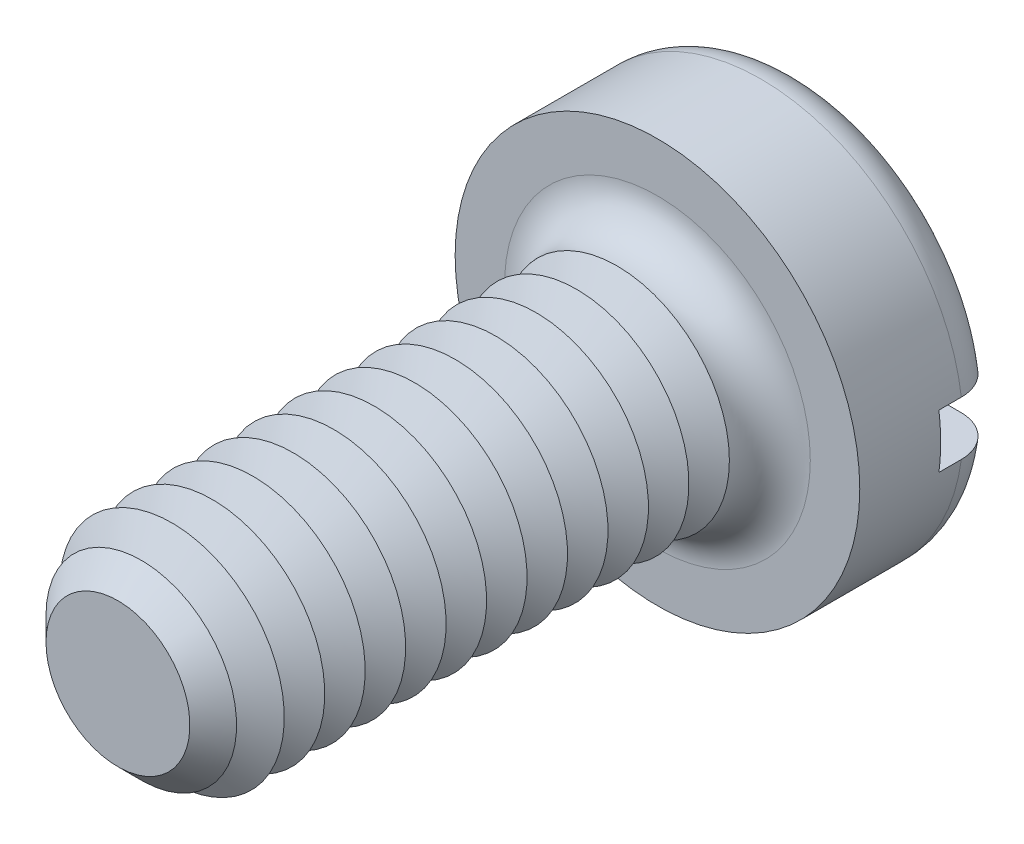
SolidWorks part; units mm, degrees
ref_plane "Front Plane" through (0, 0, 0) normal (0, 0, 1) x (1, 0, 0)
ref_plane "Top Plane" through (0, 0, 0) normal (0, 1, 0) x (1, 0, 0)
ref_plane "Right Plane" through (0, 0, 0) normal (1, 0, 0) x (0, 0, -1)
sketch "Sketch3" plane through (0, 0, 0) normal (0, 0, 1) x (1, 0, 0)
  circle A0 centre (0, 0) radius 2.25
  dimension "D1" = 4.5
extrude "Boss-Extrude2" add sketch "Sketch3" against normal blind 1.6
sketch "Sketch4" plane through (0, 0, 0) normal (0, 0, 1) x (1, 0, 0)
  circle A0 centre (0, 0) radius 1.25
  dimension "D1" = 2.5
extrude "Boss-Extrude3" add sketch "Sketch4" along normal blind 6
fillet "Fillet1" radius 0.45 2 edges at (2.25, 0, -1.6) (1.25, 0, 0)
chamfer "Chamfer1" distance 0.45 angle 45 1 edges at (1.25, 0, 6)
sketch "Sketch5" plane through (0, 0, 0) normal (1, 0, 0) x (0, 0, -1)
  line L0 (1.6944, 0) -> (-7.6738, 0) construction
sketch "Sketch6" plane through (0, 0, 0) normal (1, 0, 0) x (0, 0, -1)
  line L0 (-0.45, 1.25) -> (-0.675, 0.8603)
  line L1 (-0.675, 0.8603) -> (-0.9, 1.25)
  line L2 (-0.45, 1.25) -> (-5.55, 1.25) construction
  line L3 (-0.9, 1.25) -> (-0.45, 1.25)
  dimension "D1" = 0.45
revolve "Cut-Revolve1" cut sketch "Sketch6" angle 360 about L0
pattern_linear "LPattern1" count 12 spacing 0.45 along (0, 0, 1) of "Cut-Revolve1"
sketch "Sketch8" plane through (0, 0, -1.6) normal (0, 0, -1) x (-1, 0, 0)
  line L1 (2.25, -0.3) -> (-2.25, -0.3)
  line L2 (2.25, -0.3) -> (2.25, 0.3)
  line L3 (2.25, 0.3) -> (-2.25, 0.3)
  line L4 (-2.25, -0.3) -> (-2.25, 0.3)
  line L5 (2.25, -0.3) -> (-2.25, 0.3) construction
  line L6 (2.25, 0.3) -> (-2.25, -0.3) construction
  point P0 (0, 0)
  dimension "D1" = 4.5
  dimension "D2" = 0.6
extrude "Cut-Extrude1" cut sketch "Sketch8" against normal blind 0.7
